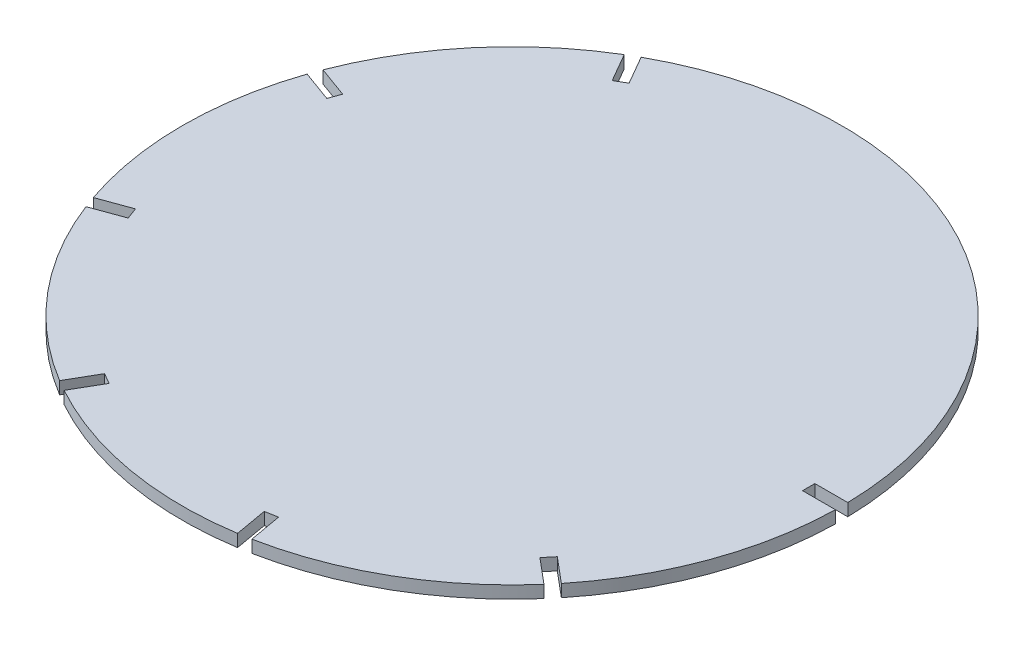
SolidWorks part; units mm, degrees
ref_plane "Front Plane" through (0, 0, 0) normal (0, 0, 1) x (1, 0, 0)
ref_plane "Top Plane" through (0, 0, 0) normal (0, 1, 0) x (1, 0, 0)
ref_plane "Right Plane" through (0, 0, 0) normal (1, 0, 0) x (0, 0, -1)
sketch "Sketch1" plane through (0, 0, 0) normal (0, 1, 0) x (1, 0, 0)
  circle A0 centre (0, 0) radius 400
  dimension "D1" = 400
extrude "Boss-Extrude1" add sketch "Sketch1" along normal blind 15 contours A0
sketch "Sketch2" plane through (0, 15, 0) normal (0, 1, 0) x (1, 0, 0)
  line L0 (0, 0) -> (400, 0) construction
  line L2 (360, 7.5) -> (465, 7.5)
  line L3 (360, 7.5) -> (360, -7.5)
  line L4 (360, -7.5) -> (465, -7.5)
  line L5 (465, 7.5) -> (465, -7.5)
  line L9 (69.8994, -353.2284) -> (88.1325, -456.6332)
  line L10 (69.8994, -353.2284) -> (55.1273, -355.8332)
  line L11 (55.1273, -355.8332) -> (73.3603, -459.238)
  line L12 (88.1325, -456.6332) -> (73.3603, -459.238)
  line L16 (280.5969, -225.6582) -> (361.0316, -293.1509)
  line L17 (280.5969, -225.6582) -> (270.9551, -237.1489)
  line L18 (270.9551, -237.1489) -> (351.3898, -304.6416)
  line L19 (361.0316, -293.1509) -> (351.3898, -304.6416)
  line L22 (0, 0) -> (69.4593, -393.9231) construction
  line L24 (-173.5048, -315.5191) -> (-226.0048, -406.4518)
  line L25 (-173.5048, -315.5191) -> (-186.4952, -308.0191)
  line L26 (-186.4952, -308.0191) -> (-238.9952, -398.9518)
  line L27 (-226.0048, -406.4518) -> (-238.9952, -398.9518)
  line L29 (0, 0) -> (306.4178, -257.115) construction
  line L31 (0, 0) -> (-200, -346.4102) construction
  line L33 (-335.7242, -130.1749) -> (-434.3919, -166.0871)
  line L34 (-335.7242, -130.1749) -> (-340.8545, -116.0796)
  line L35 (-340.8545, -116.0796) -> (-439.5222, -151.9917)
  line L36 (-434.3919, -166.0871) -> (-439.5222, -151.9917)
  line L39 (0, 0) -> (-375.877, -136.8081) construction
  line L41 (-340.8545, 116.0796) -> (-439.5222, 151.9917)
  line L42 (-340.8545, 116.0796) -> (-335.7242, 130.1749)
  line L43 (-335.7242, 130.1749) -> (-434.3919, 166.0871)
  line L44 (-439.5222, 151.9917) -> (-434.3919, 166.0871)
  line L47 (0, 0) -> (-375.877, 136.8081) construction
  line L55 (-186.4952, 308.0191) -> (-238.9952, 398.9518)
  line L56 (-186.4952, 308.0191) -> (-173.5048, 315.5191)
  line L57 (-173.5048, 315.5191) -> (-226.0048, 406.4518)
  line L58 (-238.9952, 398.9518) -> (-226.0048, 406.4518)
  line L61 (0, 0) -> (-200, 346.4102) construction
  circle A0 centre (0, 0) radius 400 construction
  point P23 (0, 0)
extrude "Cut-Extrude3" cut sketch "Sketch2" against normal blind 15
equation "\"Inner Circle\"= 350mm"
equation "\"D1@Sketch2\"= 100 + \"CutExtrude Clearing\""
equation "\"CutExtrude Clearing\"= 5mm"
